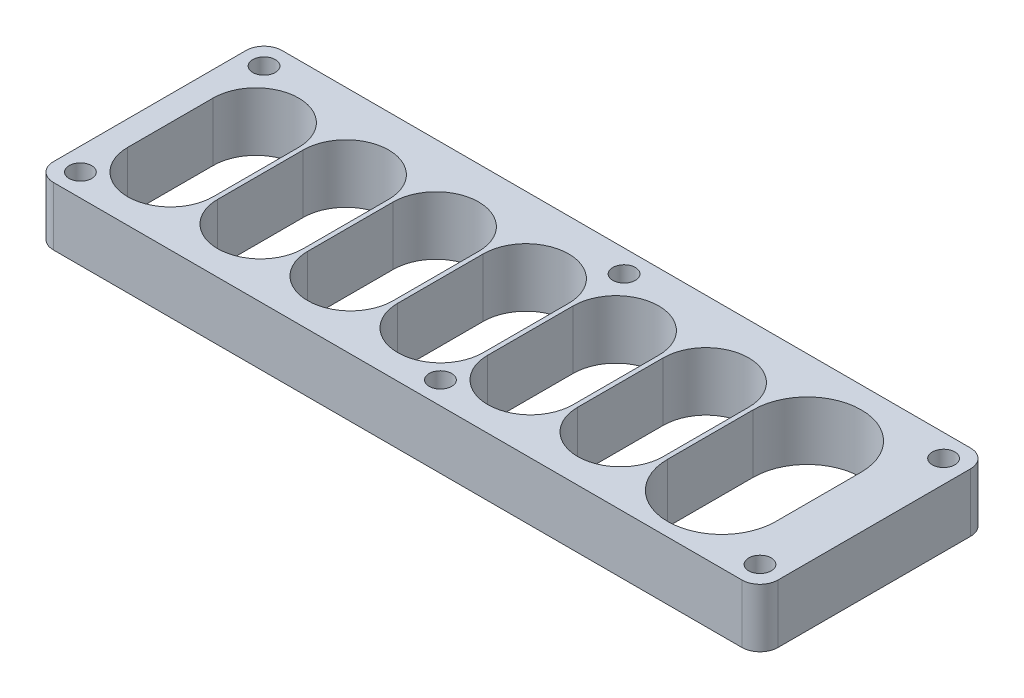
SolidWorks part; units mm, degrees
ref_plane "Front Plane" through (0, 0, 0) normal (0, 0, 1) x (1, 0, 0)
ref_plane "Top Plane" through (0, 0, 0) normal (0, 1, 0) x (1, 0, 0)
ref_plane "Right Plane" through (0, 0, 0) normal (1, 0, 0) x (0, 0, -1)
sketch "Sketch1" plane through (0, 0, 0) normal (0, 1, 0) x (1, 0, 0)
  line L1 (-161, 0) -> (0, 0)
  line L2 (-161, 0) -> (-161, -50.8)
  line L3 (-161, -50.8) -> (0, -50.8)
  line L4 (0, 0) -> (0, -50.8)
  dimension "D1" = 161
  dimension "D2" = 50.8
extrude "Boss-Extrude1" add sketch "Sketch1" along normal blind 13
sketch "Sketch2" plane through (0, 13, 0) normal (0, 1, 0) x (1, 0, 0)
  line L0 (-146, -16.8) -> (-146, -35.8) construction
  line L1 (-136.5, -16.8) -> (-136.5, -35.8)
  line L2 (-155.5, -16.8) -> (-155.5, -35.8)
  line L3 (-161, 0) -> (-161, -50.8) construction
  line L4 (-161, -50.8) -> (0, -50.8) construction
  line L5 (-126, -16.8) -> (-126, -35.8) construction
  line L6 (-116.5, -16.8) -> (-116.5, -35.8)
  line L7 (-135.5, -16.8) -> (-135.5, -35.8)
  line L8 (-106, -16.8) -> (-106, -35.8) construction
  line L9 (-96.5, -16.8) -> (-96.5, -35.8)
  line L10 (-115.5, -16.8) -> (-115.5, -35.8)
  line L11 (-86, -16.8) -> (-86, -35.8) construction
  line L12 (-76.5, -16.8) -> (-76.5, -35.8)
  line L13 (-95.5, -16.8) -> (-95.5, -35.8)
  line L14 (-66, -16.8) -> (-66, -35.8) construction
  line L15 (-56.5, -16.8) -> (-56.5, -35.8)
  line L16 (-75.5, -16.8) -> (-75.5, -35.8)
  line L17 (-46, -16.8) -> (-46, -35.8) construction
  line L18 (-36.5, -16.8) -> (-36.5, -35.8)
  line L19 (-55.5, -16.8) -> (-55.5, -35.8)
  line L20 (-23.5, -16.8) -> (-23.5, -35.8) construction
  line L21 (-11.5, -16.8) -> (-11.5, -35.8)
  line L22 (-35.5, -16.8) -> (-35.5, -35.8)
  arc A0 (-136.5, -16.8) -> (-155.5, -16.8) centre (-146, -16.8) ccw
  arc A1 (-155.5, -35.8) -> (-136.5, -35.8) centre (-146, -35.8) ccw
  arc A2 (-116.5, -16.8) -> (-135.5, -16.8) centre (-126, -16.8) ccw
  arc A3 (-135.5, -35.8) -> (-116.5, -35.8) centre (-126, -35.8) ccw
  arc A4 (-96.5, -16.8) -> (-115.5, -16.8) centre (-106, -16.8) ccw
  arc A5 (-115.5, -35.8) -> (-96.5, -35.8) centre (-106, -35.8) ccw
  arc A6 (-76.5, -16.8) -> (-95.5, -16.8) centre (-86, -16.8) ccw
  arc A7 (-95.5, -35.8) -> (-76.5, -35.8) centre (-86, -35.8) ccw
  arc A8 (-56.5, -16.8) -> (-75.5, -16.8) centre (-66, -16.8) ccw
  arc A9 (-75.5, -35.8) -> (-56.5, -35.8) centre (-66, -35.8) ccw
  arc A10 (-36.5, -16.8) -> (-55.5, -16.8) centre (-46, -16.8) ccw
  arc A11 (-55.5, -35.8) -> (-36.5, -35.8) centre (-46, -35.8) ccw
  arc A12 (-11.5, -16.8) -> (-35.5, -16.8) centre (-23.5, -16.8) ccw
  arc A13 (-35.5, -35.8) -> (-11.5, -35.8) centre (-23.5, -35.8) ccw
  point P2 (-146, -26.3)
  point P13 (-126, -26.3)
  point P20 (-106, -26.3)
  point P27 (-86, -26.3)
  point P34 (-66, -26.3)
  point P41 (-46, -26.3)
  point P48 (-23.5, -26.3)
  dimension "D3" = 19
  dimension "D9" = 19
  dimension "D27" = 19
  dimension "D1" = 5.5
  dimension "D2" = 24.5
  dimension "D4" = 15
  dimension "D5" = 35
  dimension "D6" = 15
  dimension "D7" = 19
  dimension "D8" = 19
  dimension "D10" = 15
  dimension "D11" = 19
  dimension "D12" = 55
  dimension "D13" = 19
  dimension "D14" = 19
  dimension "D15" = 15
  dimension "D16" = 75
  dimension "D17" = 15
  dimension "D18" = 19
  dimension "D19" = 19
  dimension "D20" = 95
  dimension "D21" = 15
  dimension "D22" = 19
  dimension "D23" = 19
  dimension "D24" = 115
  dimension "D25" = 149.5
  dimension "D26" = 125.5
  dimension "D28" = 15
extrude "Cut-Extrude1" cut sketch "Sketch2" against normal through all
fillet "Fillet1" radius 4 4 edges at (-161, 6.5, 0) (-161, 6.5, 50.8) (0, 6.5, 0) (0, 6.5, 50.8)
hole_wizard "Ø5.0mm Dowel Hole1" positions "Sketch4" profile "Sketch3" hole size "Ø5.0" standard "ANSI Metric"
sketch "Sketch4" plane through (0, 13, 0) normal (0, 1, 0) x (1, 0, 0)
  line L0 (-157, -50.8) -> (-4, -50.8) construction
  line L1 (-161, -4) -> (-161, -46.8) construction
  line L2 (-4, 0) -> (-157, 0) construction
  point P0 (-156, -45.8)
  point P2 (-76, -45.8)
  point P4 (-5, -45.8)
  point P6 (-5, -5)
  point P8 (-76, -5)
  point P10 (-156, -5)
  dimension "D1" = 5
  dimension "D2" = 5
  dimension "D3" = 5
  dimension "D4" = 80
  dimension "D5" = 71
sketch "Sketch3" plane through (-156, 13, 45.8) normal (1, 0, 0) x (0, 0, 1)
  line L0 (0, 0) -> (0, 13)
  line L1 (0, 13) -> (2.5, 13)
  line L2 (2.5, 13) -> (2.5, 0)
  line L5 (2.5, 0) -> (0, 0)
  line L11 (0, -6.35) -> (0, 107.95) construction
  dimension "Thru Hole Dia." = 5
  dimension "Thru Hole Depth" = 13
hole_wizard "Ø9.0 (9) Diameter Hole1" positions "Sketch8" profile "Sketch7" hole size "Ø9.0" standard "ANSI Metric"
sketch "Sketch8" plane through (0, 0, 0) normal (0, -1, 0) x (-1, 0, 0)
  point P0 (156, -45.8)
  point P3 (76, -45.8)
  point P6 (5, -45.8)
  point P9 (5, -5)
  point P12 (76, -5)
  point P15 (156, -5)
sketch "Sketch7" plane through (-156, 0, 45.8) normal (1, 0, 0) x (0, 0, -1)
  line L0 (0, 0) -> (0, 7.7039)
  line L1 (0, 7.7039) -> (4.5, 5)
  line L2 (4.5, 5) -> (4.5, 0)
  line L5 (4.5, 0) -> (0, 0)
  line L10 (0, 7.7039) -> (-4.5, 5) construction
  line L11 (0, -6.35) -> (0, 107.95) construction
  dimension "Hole Dia." = 9
  dimension "Hole Depth" = 5
  dimension "Drill Angle" = 118
